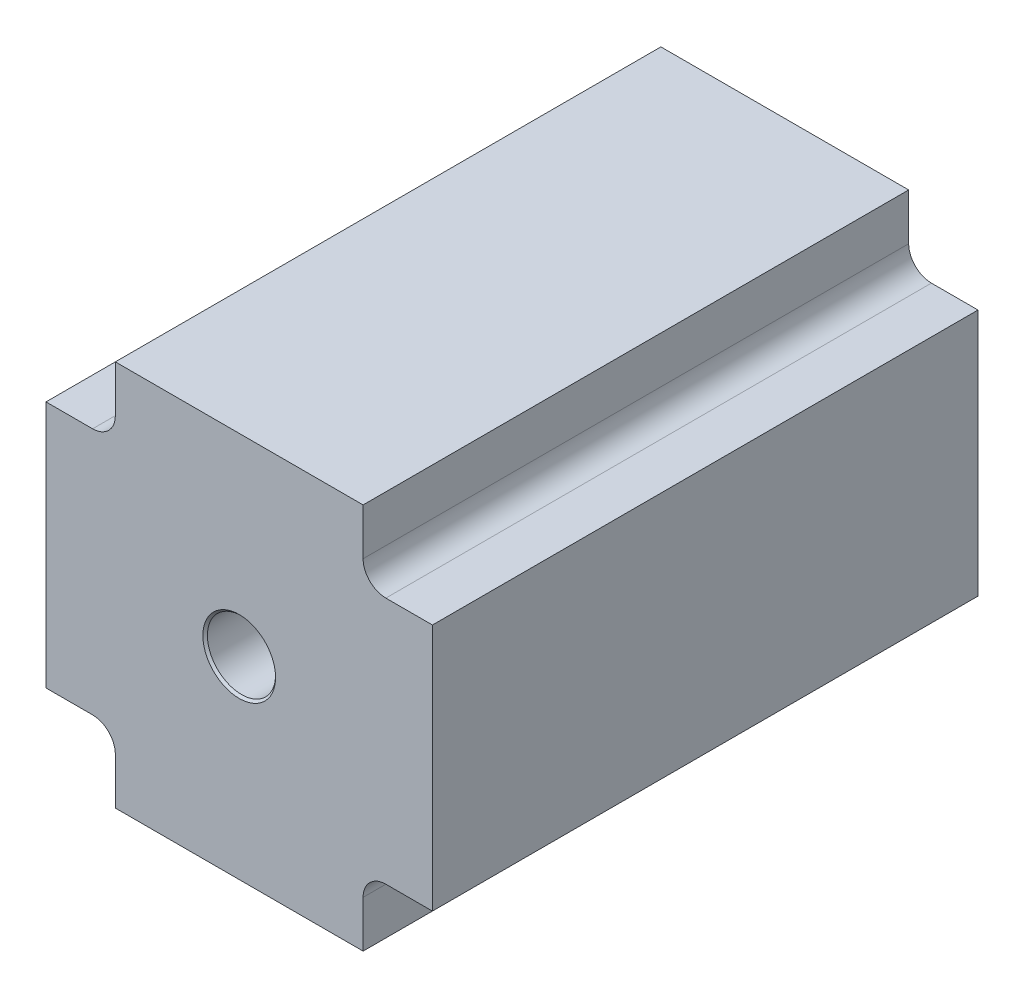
SolidWorks part; units mm, degrees
ref_plane "前视基准面" through (0, 0, 0) normal (0, 0, 1) x (1, 0, 0)
ref_plane "上视基准面" through (0, 0, 0) normal (0, 1, 0) x (1, 0, 0)
ref_plane "右视基准面" through (0, 0, 0) normal (1, 0, 0) x (0, 0, -1)
sketch "草图1" plane through (0, 0, 0) normal (0, 0, 1) x (1, 0, 0)
  line L0 (73.6849, 0) -> (-83.1554, 0) construction
  line L1 (27.25, 42.5) -> (-27.25, 42.5)
  line L2 (27.25, 42.5) -> (27.25, 27.25)
  line L3 (27.25, -42.5) -> (-27.25, -42.5)
  line L4 (-27.25, 42.5) -> (-27.25, 27.25)
  line L5 (27.25, 42.5) -> (-27.25, -42.5) construction
  line L6 (27.25, -42.5) -> (-27.25, 42.5) construction
  line L7 (0, -54.7285) -> (0, 60.804) construction
  line L8 (-27.25, 27.25) -> (-42.5, 27.25)
  line L9 (42.5, -27.25) -> (27.25, -27.25)
  line L10 (42.5, -27.25) -> (42.5, 27.25)
  line L11 (42.5, 27.25) -> (27.25, 27.25)
  line L12 (-42.5, -27.25) -> (-42.5, 27.25)
  line L13 (42.5, -27.25) -> (-42.5, 27.25) construction
  line L14 (42.5, 27.25) -> (-42.5, -27.25) construction
  line L15 (-27.25, -27.25) -> (-27.25, -42.5)
  line L16 (-27.25, -27.25) -> (-42.5, -27.25)
  line L17 (27.25, -27.25) -> (27.25, -42.5)
  point P0 (0, 0)
  point P10 (0, 0)
  dimension "D1" = 54.5
  dimension "D2" = 85
  dimension "D3" = 54.5
  dimension "D4" = 85
extrude "凸台-拉伸1" add sketch "草图1" along normal blind 120
sketch "草图3" plane through (0, 0, 120) normal (0, 0, 1) x (1, 0, 0)
  circle A0 centre (0, 0) radius 7.5
  dimension "D1" = 15
extrude "切除-拉伸2" cut sketch "草图3" against normal through all
chamfer "倒角3" distance 0.5 angle 45 2 edges at (7.5, 0, 0) (7.5, 0, 120)
fillet "圆角1" radius 5 4 edges at (-27.25, -27.25, 60) (27.25, -27.25, 60) (27.25, 27.25, 60) (-27.25, 27.25, 60)
